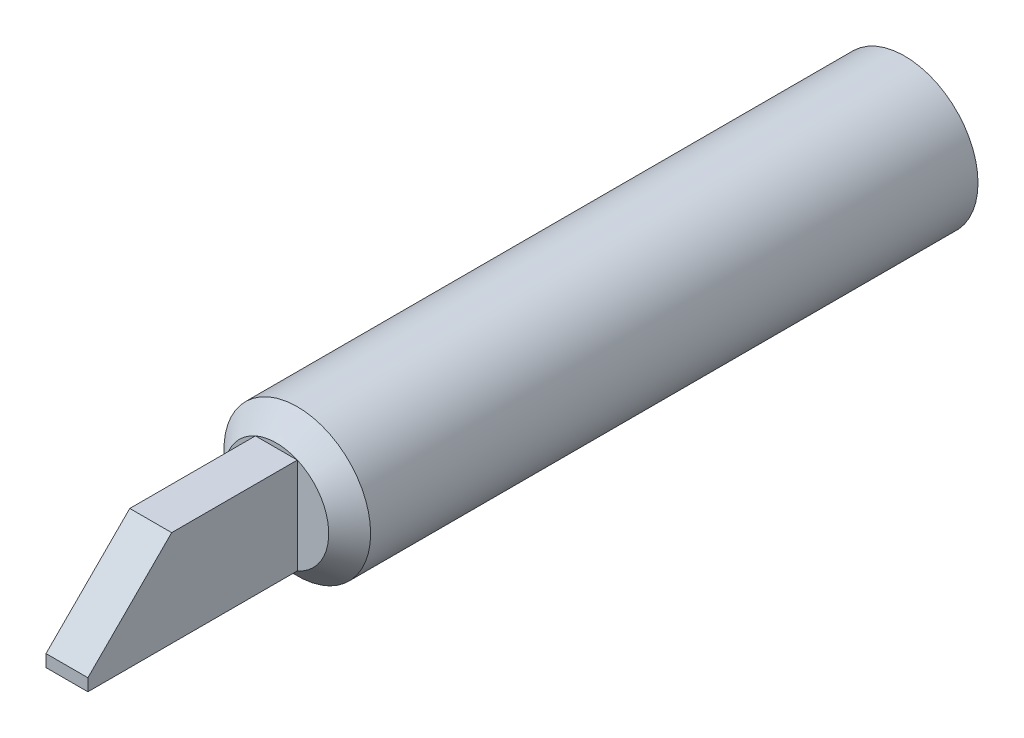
SolidWorks part; units mm, degrees
ref_plane "Plane1" through (0, 0, 0) normal (0, 0, 1) x (1, 0, 0)
ref_plane "Plane2" through (0, 0, 0) normal (0, 1, 0) x (1, 0, 0)
ref_plane "Plane3" through (0, 0, 0) normal (1, 0, 0) x (0, 0, -1)
sketch "Sketch1" plane through (0, 0, 0) normal (0, 0, 1) x (1, 0, 0)
  circle A0 centre (0, 0) radius 3.5
  dimension "D1" = 7
extrude "Base-Extrude" add sketch "Sketch1" along normal blind 30
chamfer "Chamfer2" distance 1 angle 45 1 edges at (3.5, 0, 30)
sketch "Sketch2" plane through (0, 0, 30) normal (0, 0, 1) x (1, 0, 0)
  line L1 (-1, 2.2913) -> (1, 2.2913)
  line L2 (-1, 2.2913) -> (-1, -2.2913)
  line L3 (-1, -2.2913) -> (1, -2.2913)
  line L4 (1, 2.2913) -> (1, -2.2913)
  circle A0 centre (0, 0) radius 2.5 construction
  dimension "D1" = 2
extrude "Boss-Extrude1" add sketch "Sketch2" along normal blind 10
chamfer "Chamfer5" distance 4 angle 45 1 edges at (0, 2.2913, 40)
